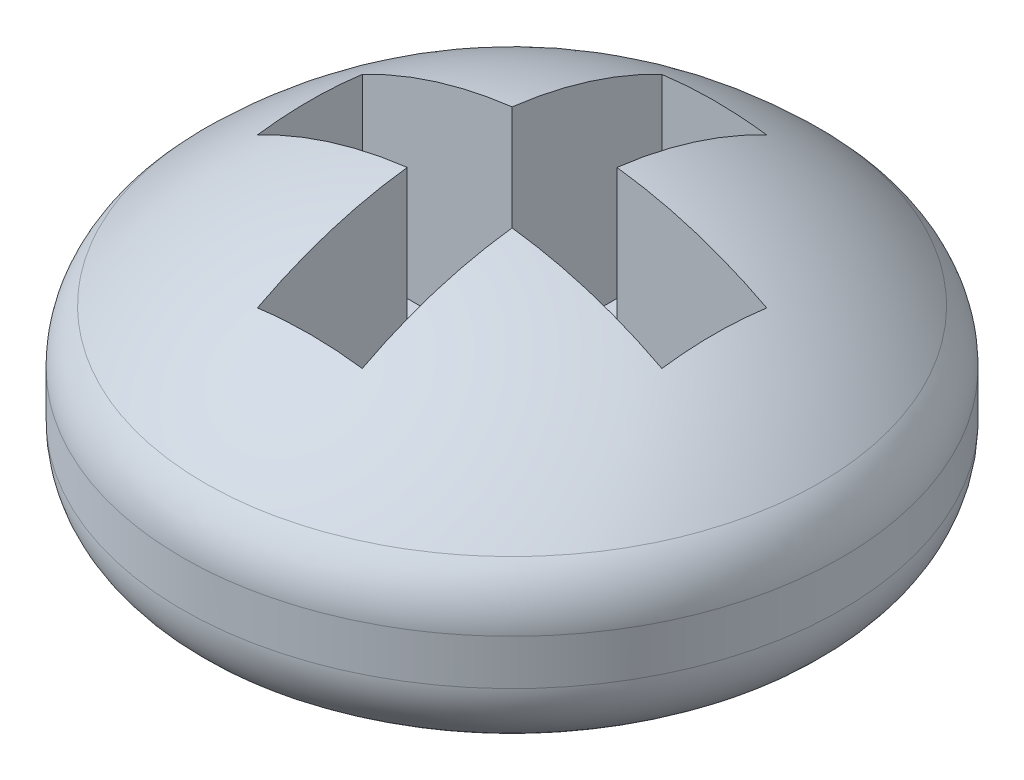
SolidWorks part; units mm, degrees
ref_plane "Front Plane" through (0, 0, 0) normal (0, 0, 1) x (1, 0, 0)
ref_plane "Top Plane" through (0, 0, 0) normal (0, 1, 0) x (1, 0, 0)
ref_plane "Right Plane" through (0, 0, 0) normal (1, 0, 0) x (0, 0, -1)
imported_body "Imported3"
sketch "Sketch1" plane through (0, 31.23, 0) normal (0, -1, 0) x (1, 0, 0)
  circle A0 centre (0, 0) radius 2.2
extrude "Boss-Extrude1" add sketch "Sketch1" along normal blind 1
imported_body "Surface-Imported1"
ref_plane "Plane1" through (0, 30.73, 0) normal (0, -1, 0) x (1, 0, 0)
sketch "Sketch2" plane through (0, 30.73, 0) normal (0, -1, 0) x (1, 0, 0)
  line L0 (-0.35, 1.35) -> (-0.35, 0.35)
  line L1 (-0.35, 0.35) -> (-1.35, 0.35)
  line L2 (-1.35, 0.35) -> (-1.35, -0.35)
  line L3 (-1.35, -0.35) -> (-0.35, -0.35)
  line L4 (-0.35, -0.35) -> (-0.35, -1.35)
  line L5 (-0.35, -1.35) -> (0.35, -1.35)
  line L6 (0.35, -1.35) -> (0.35, -0.35)
  line L7 (0.35, -0.35) -> (1.35, -0.35)
  line L8 (1.35, -0.35) -> (1.35, 0.35)
  line L9 (1.35, 0.35) -> (0.35, 0.35)
  line L10 (0.35, 0.35) -> (0.35, 1.35)
  line L11 (0.35, 1.35) -> (-0.35, 1.35)
extrude "Cut-Extrude1" cut sketch "Sketch2" against normal up to surface
fillet "Fillet1" radius 0.5 2 edges at (0, 30.23, -2.2) (0, 31.23, -2.2)
